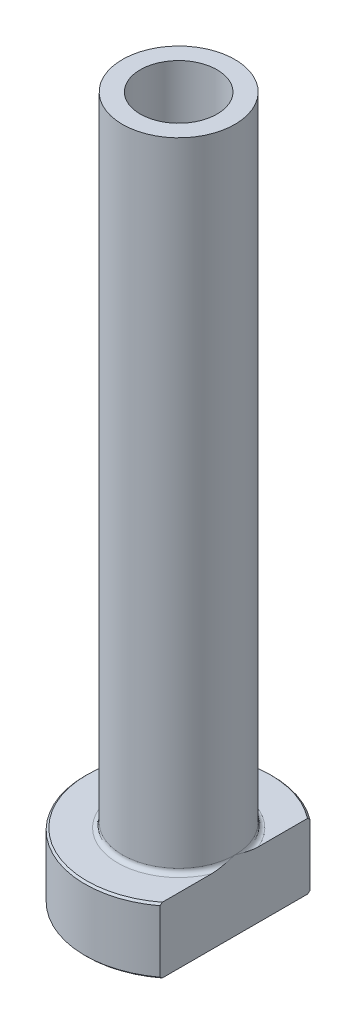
SolidWorks part; units mm, degrees
ref_plane "Front Plane" through (0, 0, 0) normal (0, 0, 1) x (1, 0, 0)
ref_plane "Top Plane" through (0, 0, 0) normal (0, 1, 0) x (1, 0, 0)
ref_plane "Right Plane" through (0, 0, 0) normal (1, 0, 0) x (0, 0, -1)
sketch "Sketch1" plane through (0, 0, 0) normal (0, 0, 1) x (1, 0, 0)
  line L0 (-4.1, 75) -> (-6, 75)
  line L1 (-6, 75) -> (-6, 7)
  line L2 (-6, 7) -> (-10, 7)
  line L3 (-10, 7) -> (-10, 0)
  line L4 (8.8, 0) -> (-8.8, 0) construction
  line L5 (-10, 0) -> (-4.35, 0)
  line L6 (-4.1, 30) -> (-4.1, 75)
  line L7 (0, 92.1877) -> (0, -15.5353) construction
  line L8 (0, -11) -> (0, 11) construction
  line L9 (-4.1, 30) -> (-4.35, 18)
  line L10 (-4.35, 18) -> (-4.35, 0)
  dimension "D1" = 0.25
  dimension "ID" = 8.2
  dimension "OD" = 12
  dimension "L" = 75
  dimension "H" = 20
  dimension "T" = 7
  dimension "N" = 45
  dimension "D2" = 12
  dimension "L-N" = 30
revolve "Revolve1" add sketch "Sketch1" angle 360 about L7
fillet "Fillet1" radius 0.5 1 edges at (0, 7, 6)
chamfer "Chamfer1" distance 0.2 angle 45 2 edges at (0, 7, 10) (0, 0, 10)
sketch "Sketch2" plane through (0, 0, 0) normal (0, -1, 0) x (1, 0, 0)
  line L0 (6, 8) -> (6, -8)
  circle A0 centre (0, 0) radius 10 construction
  arc A1 (6, 8) -> (6, -8) centre (0, 0) cw
  circle A2 centre (0, 0) radius 6 construction
extrude "Cut-Extrude1" cut sketch "Sketch2" against normal through all
chamfer "Chamfer2" distance 0.5 angle 45 1 edges at (0, 0, 4.35)
